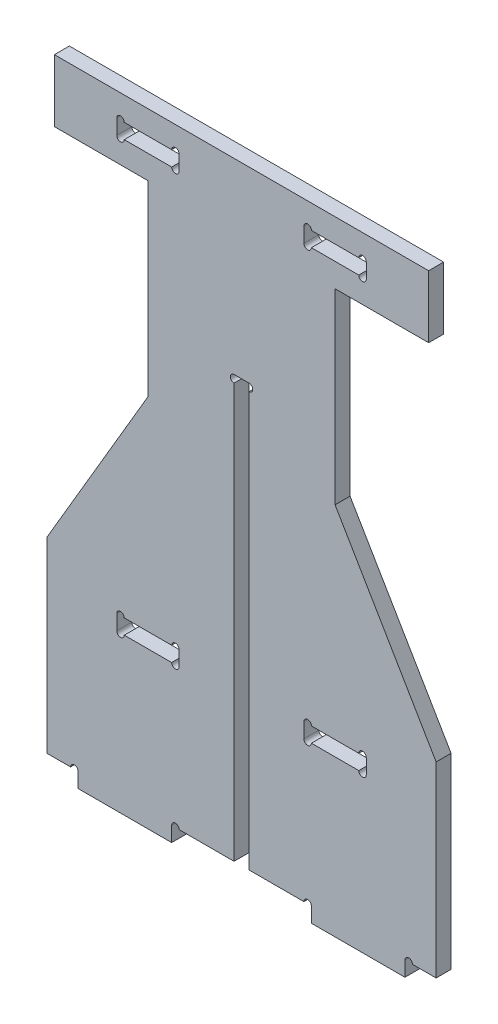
SolidWorks part; units mm, degrees
ref_plane "Front" through (0, 0, 0) normal (0, 0, 1) x (1, 0, 0)
ref_plane "Top" through (0, 0, 0) normal (0, 1, 0) x (1, 0, 0)
ref_plane "Right" through (0, 0, 0) normal (1, 0, 0) x (0, 0, -1)
sketch "Sketch1" plane through (0, 0, 0) normal (0, 0, -1) x (1, 0, 0)
  line L0 (0, 617.5571) -> (0, -338.413) construction
  line L1 (-150, 0) -> (150, 0)
  line L2 (150, 0) -> (150, 50)
  line L3 (150, 50) -> (75, 50)
  line L4 (75, 50) -> (75, 200)
  line L5 (75, 200) -> (156, 338)
  line L6 (156, 338) -> (156, 488)
  line L7 (156, 488) -> (137, 488)
  line L8 (131, 488) -> (131, 500)
  line L9 (131, 500) -> (56, 500)
  line L10 (56, 500) -> (56, 488)
  line L11 (50, 488) -> (6, 488)
  line L12 (6, 488) -> (6, 156)
  line L13 (6, 150) -> (-6, 150)
  line L15 (-6, 488) -> (-6, 156)
  line L16 (-50, 488) -> (-6, 488)
  line L17 (-56, 500) -> (-56, 488)
  line L18 (-131, 500) -> (-56, 500)
  line L19 (-131, 488) -> (-131, 500)
  line L20 (-156, 488) -> (-137, 488)
  line L21 (-156, 338) -> (-156, 488)
  line L22 (-75, 200) -> (-156, 338)
  line L23 (-75, 50) -> (-75, 200)
  line L24 (-150, 50) -> (-75, 50)
  line L25 (-150, 0) -> (-150, 50)
  line L26 (56, 19) -> (94, 19)
  line L27 (56, 31) -> (94, 31)
  line L28 (100, 31) -> (100, 19)
  line L29 (50, 31) -> (50, 19)
  line L30 (75, 45.4288) -> (75, 4.4864) construction
  line L32 (56, 375) -> (94, 375)
  line L33 (50, 375) -> (50, 363)
  line L34 (56, 363) -> (94, 363)
  line L35 (100, 375) -> (100, 363)
  line L43 (50, 19) -> (50, 439.609) construction
  line L44 (50, 19) -> (100, 19) construction
  line L45 (50, 31) -> (100, 31) construction
  line L46 (-50, 31) -> (-50, 19)
  line L47 (-56, 19) -> (-94, 19)
  line L48 (-56, 31) -> (-94, 31)
  line L49 (-100, 31) -> (-100, 19)
  line L50 (-56, 375) -> (-94, 375)
  line L51 (-100, 375) -> (-100, 363)
  line L52 (-56, 363) -> (-94, 363)
  line L53 (-50, 375) -> (-50, 363)
  arc A0 (6, 150) -> (6, 156) centre (6, 153) ccw
  arc A1 (-6, 156) -> (-6, 150) centre (-6, 153) ccw
  arc A2 (100, 31) -> (94, 31) centre (97, 31) ccw
  arc A3 (94, 19) -> (100, 19) centre (97, 19) ccw
  arc A4 (56, 31) -> (50, 31) centre (53, 31) ccw
  arc A5 (50, 19) -> (56, 19) centre (53, 19) ccw
  arc A6 (-56, 31) -> (-50, 31) centre (-53, 31) cw
  arc A7 (-50, 19) -> (-56, 19) centre (-53, 19) cw
  arc A8 (-100, 31) -> (-94, 31) centre (-97, 31) cw
  arc A9 (-94, 19) -> (-100, 19) centre (-97, 19) cw
  arc A10 (100, 375) -> (94, 375) centre (97, 375) ccw
  arc A11 (94, 363) -> (100, 363) centre (97, 363) ccw
  arc A12 (56, 375) -> (50, 375) centre (53, 375) ccw
  arc A13 (50, 363) -> (56, 363) centre (53, 363) ccw
  arc A14 (-100, 375) -> (-94, 375) centre (-97, 375) cw
  arc A15 (-94, 363) -> (-100, 363) centre (-97, 363) cw
  arc A16 (-50, 363) -> (-56, 363) centre (-53, 363) cw
  arc A17 (-56, 375) -> (-50, 375) centre (-53, 375) cw
  arc A22 (50, 488) -> (56, 488) centre (53, 488) ccw
  arc A23 (131, 488) -> (137, 488) centre (134, 488) ccw
  arc A24 (-56, 488) -> (-50, 488) centre (-53, 488) ccw
  arc A25 (-137, 488) -> (-131, 488) centre (-134, 488) ccw
  point P23 (0, 150)
  point P34 (0, 0)
  point P88 (0, -338.413)
extrude "Boss-Extrude1" add sketch "Sketch1" along normal blind 12
equation "\"WoodThickness\"= 12mm"
equation "\"Table Hight\"= 500mm"
equation "\"SlotWidth1\"= 75mm"
equation "\"SlotWidth2\"= 50mm"
equation "\"CoreWidth\"= 150"
equation "\"D1@Sketch1\"=\"Table Hight\""
equation "\"D5@Sketch1\"=\"CoreWidth\""
equation "\"D7@Sketch1\"=\"CoreWidth\""
equation "\"D8@Sketch1\"=\"SlotWidth1\""
equation "\"D12@Sketch1\"=\"SlotWidth2\""
equation "\"D17@Sketch1\"=\"SlotWidth2\""
equation "\"D11@Sketch1\"=\"CoreWidth\""
equation "\"D18@Sketch1\"=\"WoodThickness\""
equation "\"D2@Sketch1\"=\"WoodThickness\"/2"
equation "\"D15@Sketch1\"=\"SlotWidth2\""
equation "\"D4@Sketch1\"=\"SlotWidth2\""
equation "\"D14@Sketch1\"=\"WoodThickness\""
equation "\"D10@Sketch1\"=\"CoreWidth\""
equation "\"D6@Sketch1\"=\"SlotWidth1\""
equation "\"D9@Sketch1\"=\"CoreWidth\""
equation "\"D3@Sketch1\"=\"WoodThickness\""
equation "\"D16@Sketch1\"=\"SlotWidth1\""
